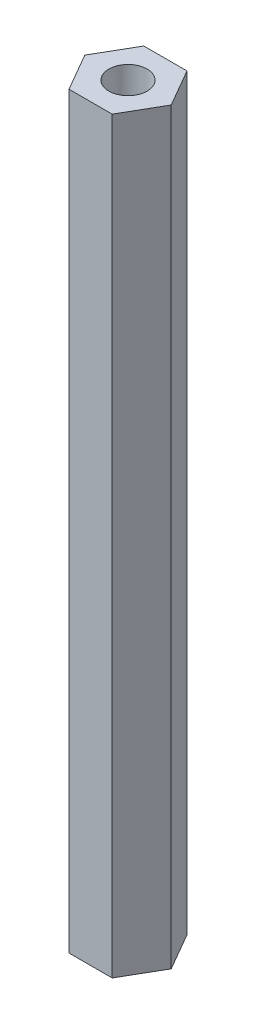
SolidWorks part; units mm, degrees
ref_plane "Front Plane" through (0, 0, 0) normal (0, 0, 1) x (1, 0, 0)
ref_plane "Top Plane" through (0, 0, 0) normal (0, 1, 0) x (1, 0, 0)
ref_plane "Right Plane" through (0, 0, 0) normal (1, 0, 0) x (0, 0, -1)
sketch "Sketch1" plane through (0, 0, 0) normal (0, 1, 0) x (1, 0, 0)
  line L1 (1.8331, 3.175) -> (-1.8331, 3.175)
  line L2 (-1.8331, 3.175) -> (-3.6662, 0)
  line L3 (-3.6662, 0) -> (-1.8331, -3.175)
  line L4 (-1.8331, -3.175) -> (1.8331, -3.175)
  line L5 (1.8331, -3.175) -> (3.6662, 0)
  line L6 (3.6662, 0) -> (1.8331, 3.175)
  circle A0 centre (0, 0) radius 3.175 construction
  circle A1 centre (0, 0) radius 1.6256
  dimension "D2" = 3.2512
  dimension "D1" = 6.35
extrude "Boss-Extrude1" add sketch "Sketch1" along normal blind 63.5
